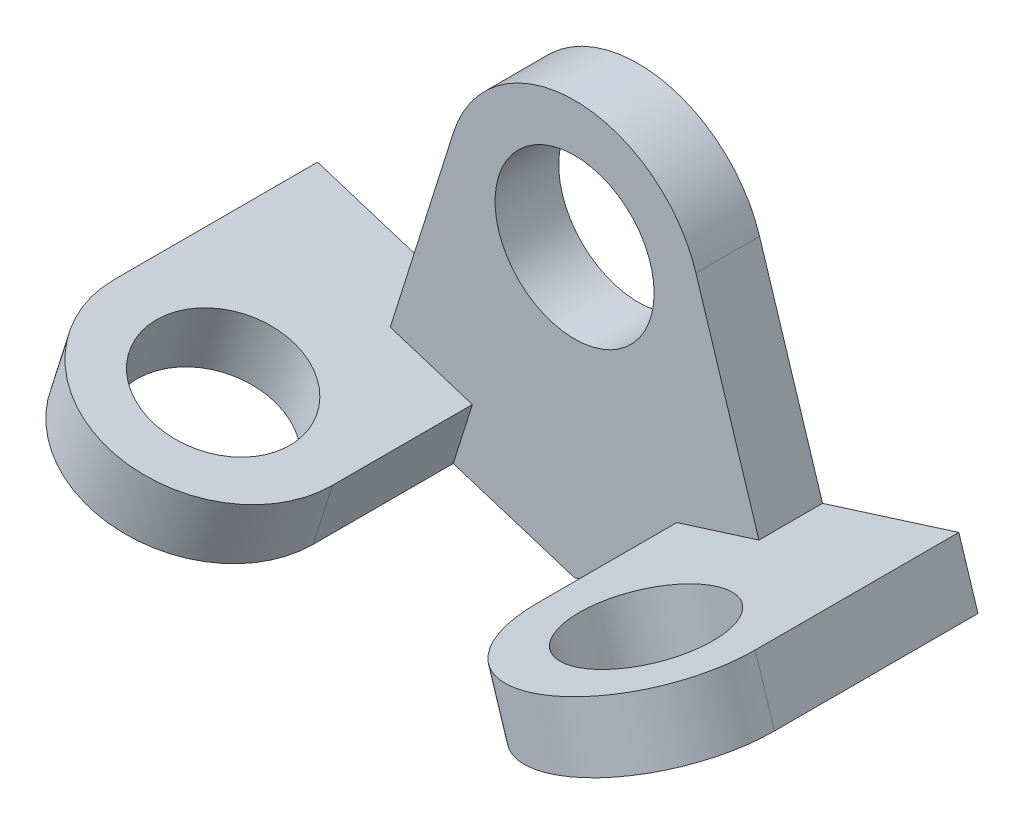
SolidWorks part; units mm, degrees
ref_plane "Front Plane" through (0, 0, 0) normal (0, 0, 1) x (1, 0, 0)
ref_plane "Top Plane" through (0, 0, 0) normal (0, 1, 0) x (1, 0, 0)
ref_plane "Right Plane" through (0, 0, 0) normal (1, 0, 0) x (0, 0, -1)
sketch "Sketch1" plane through (0, 0, 0) normal (0, 0, 1) x (1, 0, 0)
  line L0 (-31.9798, 10.0832) -> (-19.0743, 51.0141)
  line L1 (0, 111.5102) -> (0, -2.8006) construction
  line L2 (31.9798, 10.0832) -> (19.0743, 51.0141)
  line L3 (0, 0) -> (31.9798, 10.0832)
  line L4 (0, 0) -> (-31.9798, 10.0832)
  arc A0 (-19.0743, 51.0141) -> (19.0743, 51.0141) centre (0, 45) cw
  circle A1 centre (0, 45) radius 12.5
  dimension "D3" = 20
  dimension "D4" = 25
  dimension "D1" = 17.5
  dimension "D2" = 35
  dimension "D5" = 45
extrude "Boss-Extrude1" add sketch "Sketch1" along normal blind 10
sketch "Sketch2" plane through (0, 0, 0) normal (0, 0, -1) x (-1, 0, 0)
  line L0 (19.0743, 6.0141) -> (16.0673, 15.5513)
  line L1 (31.9798, 10.0832) -> (0, 0) construction
  line L2 (16.0673, 15.5513) -> (50.4011, 26.3767)
  line L3 (50.4011, 26.3767) -> (53.4081, 16.8395)
  line L4 (53.4081, 16.8395) -> (19.0743, 6.0141)
  line L5 (0, 65) -> (0, 0) construction
  line L6 (-19.0743, 6.0141) -> (-16.0673, 15.5513)
  line L7 (-16.0673, 15.5513) -> (-50.4011, 26.3767)
  line L8 (-53.4081, 16.8395) -> (-19.0743, 6.0141)
  line L9 (-50.4011, 26.3767) -> (-53.4081, 16.8395)
  arc A0 (19.0743, 51.0141) -> (-19.0743, 51.0141) centre (0, 45) ccw construction
  dimension "D1" = 10
  dimension "D2" = 20
  dimension "D3" = 36
extrude "Boss-Extrude5" add sketch "Sketch2" against normal blind 32
sketch "Sketch7" plane through (-3.0071, 9.5372, 0) normal (-0.3007, 0.9537, 0) x (0.9537, 0.3007, 0)
  line L0 (20, -32) -> (56, -32) construction
  line L1 (20, -32) -> (56, -32)
  arc A0 (20, -32) -> (56, -32) centre (38, -32) ccw
extrude "Boss-Extrude6" add sketch "Sketch7" against normal blind 10
sketch "Sketch8" plane through (-3.0071, 9.5372, 0) normal (-0.3007, 0.9537, 0) x (0.9537, 0.3007, 0)
  circle A0 centre (38, -32) radius 11
  dimension "D1" = 22
extrude "Cut-Extrude3" cut sketch "Sketch8" against normal through all
sketch "Sketch9" plane through (3.0071, 9.5372, 0) normal (0.3007, 0.9537, 0) x (0.9537, -0.3007, 0)
  line L0 (-56, -32) -> (-20, -32) construction
  line L1 (-56, -32) -> (-20, -32)
  arc A0 (-20, -32) -> (-56, -32) centre (-38, -32) cw
extrude "Boss-Extrude7" add sketch "Sketch9" against normal blind 10
sketch "Sketch10" plane through (3.0071, 9.5372, 0) normal (0.3007, 0.9537, 0) x (0.9537, -0.3007, 0)
  circle A0 centre (-38, -32) radius 11
  dimension "D1" = 22
extrude "Cut-Extrude4" cut sketch "Sketch10" against normal through all
